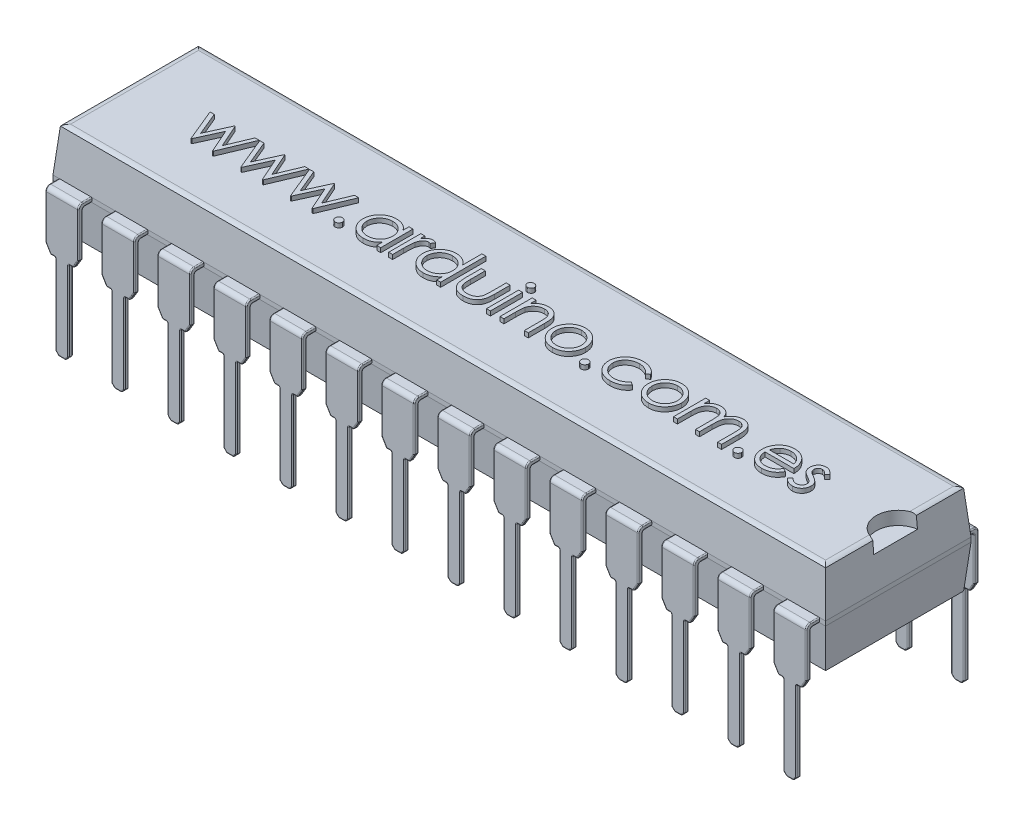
SolidWorks part; units mm, degrees
ref_plane "Alzado" through (0, 0, 0) normal (0, 0, 1) x (1, 0, 0)
ref_plane "Planta" through (0, 0, 0) normal (0, 1, 0) x (1, 0, 0)
ref_plane "Vista lateral" through (0, 0, 0) normal (1, 0, 0) x (0, 0, -1)
imported_body "User Library-DIP28_K_X_F6rper DIP28_1-1-surface1"
imported_body "User Library-DIP28_Pins Narrow_1-1-surface1"
imported_body "User Library-DIP28_Pins Narrow_1-2-surface1"
imported_body "User Library-DIP28_Pins Narrow_1-3-surface1"
imported_body "User Library-DIP28_Pins Narrow_1-4-surface1"
imported_body "User Library-DIP28_Pins Narrow_1-5-surface1"
imported_body "User Library-DIP28_Pins Narrow_1-6-surface1"
imported_body "User Library-DIP28_Pins Narrow_1-7-surface1"
imported_body "User Library-DIP28_Pins Narrow_1-8-surface1"
imported_body "User Library-DIP28_Pins Narrow_1-9-surface1"
imported_body "User Library-DIP28_Pins Narrow_1-10-surface1"
imported_body "User Library-DIP28_Pins Narrow_1-11-surface1"
imported_body "User Library-DIP28_Pins Narrow_1-12-surface1"
imported_body "User Library-DIP28_Pins Narrow_1-13-surface1"
imported_body "User Library-DIP28_Pins Narrow_1-14-surface1"
imported_body "User Library-DIP28_Pins Narrow_1-15-surface1"
imported_body "User Library-DIP28_Pins Narrow_1-16-surface1"
imported_body "User Library-DIP28_Pins Narrow_1-17-surface1"
imported_body "User Library-DIP28_Pins Narrow_1-18-surface1"
imported_body "User Library-DIP28_Pins Narrow_1-19-surface1"
imported_body "User Library-DIP28_Pins Narrow_1-20-surface1"
imported_body "User Library-DIP28_Pins Narrow_1-21-surface1"
imported_body "User Library-DIP28_Pins Narrow_1-22-surface1"
imported_body "User Library-DIP28_Pins Narrow_1-23-surface1"
imported_body "User Library-DIP28_Pins Narrow_1-24-surface1"
imported_body "User Library-DIP28_Pins Narrow_1-25-surface1"
imported_body "User Library-DIP28_Pins Narrow_1-26-surface1"
imported_body "User Library-DIP28_Pins Narrow_1-27-surface1"
imported_body "User Library-DIP28_Pins Narrow_1-28-surface1"
sketch "Croquis2" plane through (0, 4.57, 0) normal (0, 1, 0) x (1, 0, 0)
  text T0 "www.arduino.com.es" font "Century Gothic" height 2
extrude "Saliente-Extruir2" add sketch "Croquis2" along normal blind 0.2
